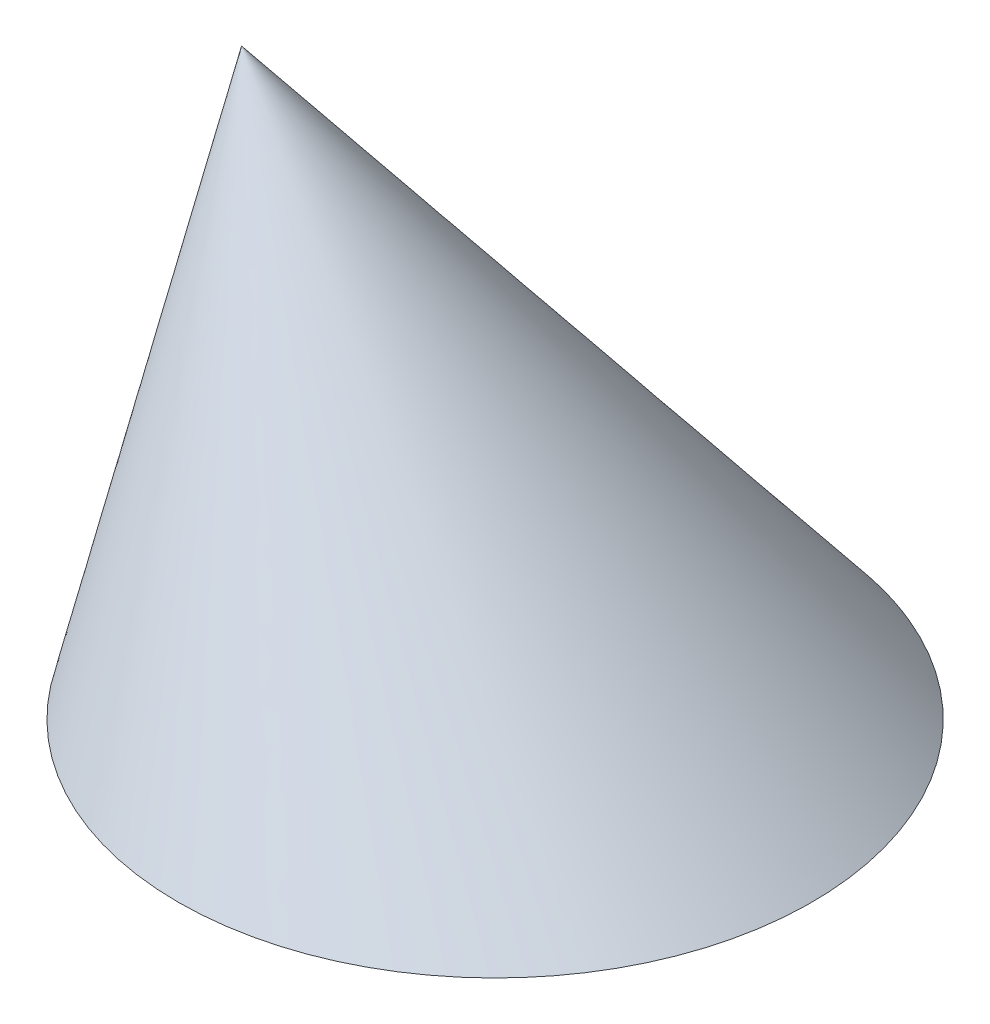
SolidWorks part; units mm, degrees
ref_plane "前视基准面" through (0, 0, 0) normal (0, 0, 1) x (1, 0, 0)
ref_plane "上视基准面" through (0, 0, 0) normal (0, 1, 0) x (1, 0, 0)
ref_plane "右视基准面" through (0, 0, 0) normal (1, 0, 0) x (0, 0, -1)
sketch "草图1" plane through (0, 0, 0) normal (0, 1, 0) x (1, 0, 0)
  circle A0 centre (0, 0) radius 250
  dimension "D" = 500
sketch "草图2" plane through (0, 0, 0) normal (0, 0, 1) x (1, 0, 0)
  point P0 (-200, 360)
  dimension "H" = 360
  dimension "C" = 200
loft "放样1" add profiles "草图1", "草图2"
